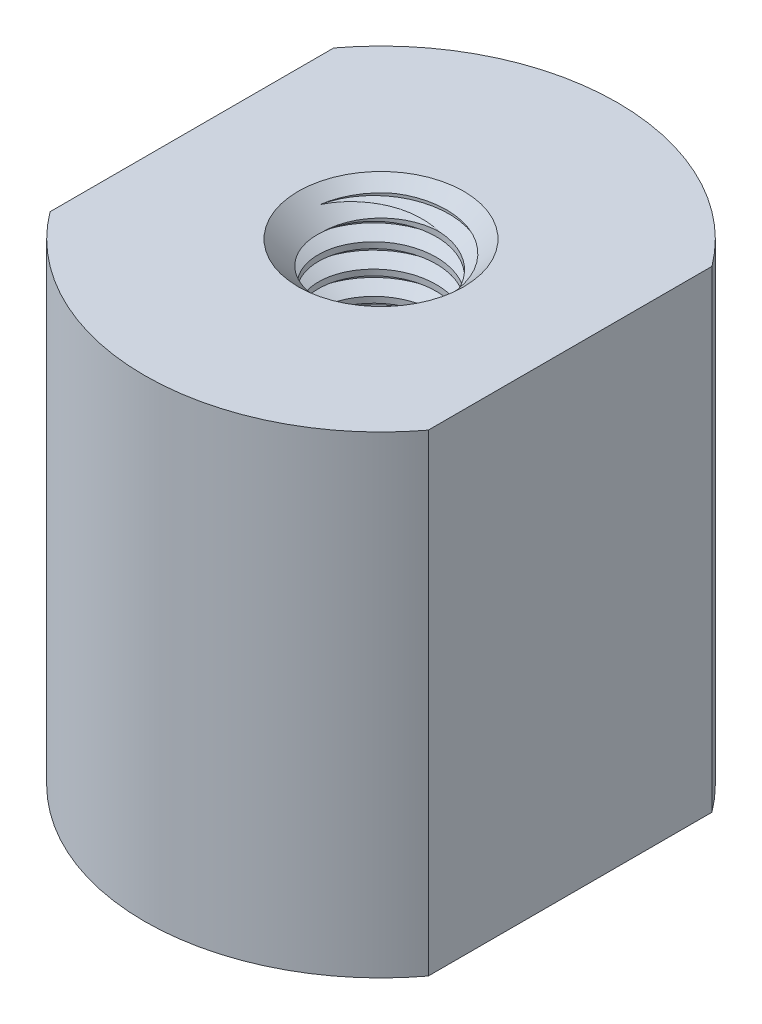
SolidWorks part; units mm, degrees
ref_plane "Front Plane" through (0, 0, 0) normal (0, 0, 1) x (1, 0, 0)
ref_plane "Top Plane" through (0, 0, 0) normal (0, 1, 0) x (1, 0, 0)
ref_plane "Right Plane" through (0, 0, 0) normal (1, 0, 0) x (0, 0, -1)
sketch "Sketch1" plane through (0, 0, 0) normal (0, 1, 0) x (1, 0, 0)
  circle A0 centre (0, 0) radius 10
  dimension "D1" = 20
extrude "Boss-Extrude1" add sketch "Sketch1" along normal blind 20
sketch "Sketch2" plane through (0, 20, 0) normal (0, 1, 0) x (1, 0, 0)
  circle A0 centre (0, 0) radius 2.5
  dimension "D1" = 5
extrude "Cut-Extrude1" cut sketch "Sketch2" against normal blind 12
chamfer "Chamfer1" distance 1 angle 45 1 edges at (0, 20, 2.5)
thread "Thread1" pitch 1 start angle 0, offset 11, length 21, pitch 1, diameter 5
ref_plane "Plane1" through (-2.5, 30, 0) normal (0, 0, 1) x (-1, 0, 0)
sketch "Thread Profile1" plane through (-2.5, 30, 0) normal (0, 0, 1) x (-1, 0, 0)
  line L0 (0, 0) -> (0, 1) construction
  line L1 (0, 0) -> (0.5413, 0.3125)
  line L2 (0.5413, 0.3125) -> (0.5413, 0.4375)
  line L3 (0.5413, 0.4375) -> (0, 0.75)
  line L4 (0.5413, 0.375) -> (0, 0.375) construction
  line L11 (0, 0) -> (0, 0.75)
  point P2 (0, 0)
  dimension "Pitch" = 1
  dimension "Profile_Angle" = 60
  dimension "Profile_Land" = 0.125
  dimension "Profile_Height" = 0.5413
sketch "Sketch3" plane through (0, 20, 0) normal (0, 1, 0) x (1, 0, 0)
  line L0 (0, 10) -> (0, -10) construction
  line L1 (-8, 6) -> (-8, -6)
  line L2 (8, -6) -> (8, 6)
  arc A0 (-8, 6) -> (-8, -6) centre (0, 0) ccw
  circle A1 centre (0, 0) radius 10 construction
  arc A2 (8, -6) -> (8, 6) centre (0, 0) ccw
  dimension "D1" = 8
  dimension "D2" = 8
extrude "Cut-Extrude2" cut sketch "Sketch3" against normal up to next
